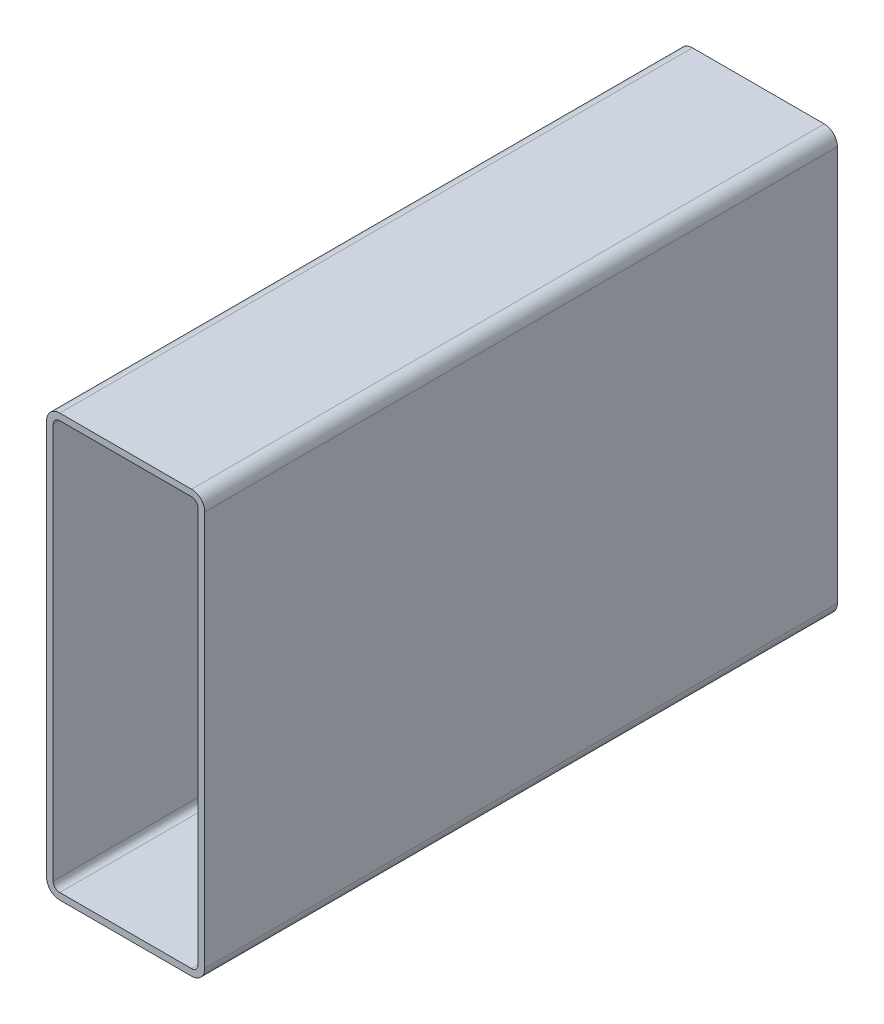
SolidWorks part; units mm, degrees
ref_plane "Front Plane" through (0, 0, 0) normal (0, 0, 1) x (1, 0, 0)
ref_plane "Top Plane" through (0, 0, 0) normal (0, 1, 0) x (1, 0, 0)
ref_plane "Right Plane" through (0, 0, 0) normal (1, 0, 0) x (0, 0, -1)
sketch "Sketch1" plane through (0, 0, 0) normal (0, 0, 1) x (1, 0, 0)
sketch_block_instance "HSS8x3x0.125-1"
sketch_block "HSS8x3x0.125"
extrude "Boss-Extrude1" add sketch "Sketch1" along normal blind 304.8
